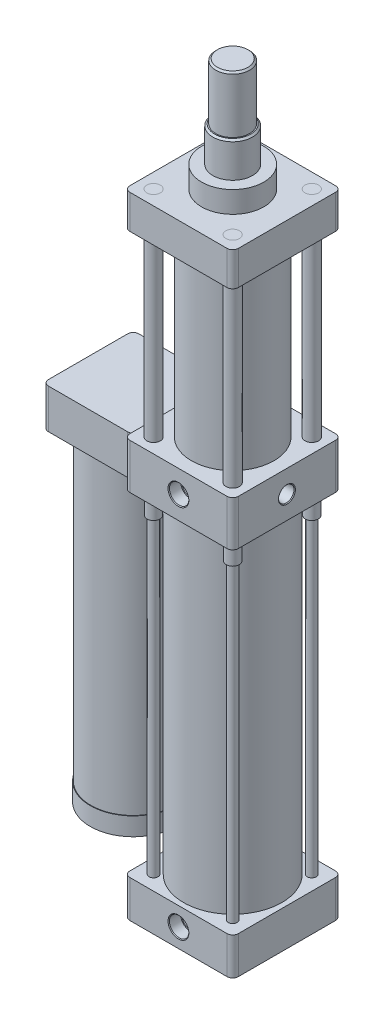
SolidWorks part; units mm, degrees
ref_plane "前视基准面" through (0, 0, 0) normal (0, 0, 1) x (1, 0, 0)
ref_plane "上视基准面" through (0, 0, 0) normal (0, 1, 0) x (1, 0, 0)
ref_plane "右视基准面" through (0, 0, 0) normal (1, 0, 0) x (0, 0, -1)
sketch "草图1" plane through (0, 0, 0) normal (0, 1, 0) x (1, 0, 0)
  line L0 (0, 0) -> (35, 0) construction
  line L1 (43, 48) -> (-43, 48)
  line L2 (48, 43) -> (48, -43)
  line L3 (43, -48) -> (-43, -48)
  line L4 (-48, 43) -> (-48, -43)
  line L5 (48, 48) -> (-48, -48) construction
  line L6 (48, -48) -> (-48, 48) construction
  line L7 (35, 0) -> (35, -35) construction
  arc A0 (-48, -43) -> (-43, -48) centre (-43, -43) ccw
  arc A1 (48, -43) -> (43, -48) centre (43, -43) cw
  arc A2 (43, 48) -> (48, 43) centre (43, 43) cw
  arc A3 (-48, 43) -> (-43, 48) centre (-43, 43) cw
  circle A4 centre (35, -35) radius 6
  circle A5 centre (-35, -35) radius 6
  circle A6 centre (-35, 35) radius 6
  circle A7 centre (35, 35) radius 6
  point P0 (0, 0)
  point P31 (0, 0)
  dimension "D3" = 5
  dimension "D4" = 4
  dimension "D1" = 96
  dimension "D2" = 96
extrude "凸台-拉伸1" add sketch "草图1" along normal blind 30
sketch "草图2" plane through (0, 30, 0) normal (0, 1, 0) x (1, 0, 0)
  circle A0 centre (0, 0) radius 27.5
extrude "凸台-拉伸2" add sketch "草图2" along normal blind 19
sketch "草图3" plane through (0, 49, 0) normal (0, 1, 0) x (1, 0, 0)
  circle A0 centre (0, 0) radius 17.5
extrude "凸台-拉伸3" add sketch "草图3" along normal blind 31
sketch "草图4" plane through (0, 80, 0) normal (0, 1, 0) x (1, 0, 0)
  circle A0 centre (0, 0) radius 15
extrude "凸台-拉伸4" add sketch "草图4" along normal blind 50
chamfer "倒角1" distance 1.5 angle 45 2 edges at (0, 130, 15) (0, 80, 17.5)
sketch "草图5" plane through (0, 0, 0) normal (0, -1, 0) x (1, 0, 0)
  circle A0 centre (0, 0) radius 36.5
extrude "凸台-拉伸5" add sketch "草图5" along normal blind 160
sketch "草图6" plane through (0, -160, 0) normal (0, -1, 0) x (1, 0, 0)
  line L0 (-48, -43) -> (-48, 43) construction
  line L1 (-43, 48) -> (43, 48) construction
  line L2 (48, 43) -> (48, -43) construction
  line L3 (43, -48) -> (-43, -48) construction
  line L4 (-48, -43) -> (-48, 43)
  line L5 (-43, 48) -> (43, 48)
  line L6 (48, 43) -> (48, -43)
  line L7 (43, -48) -> (-43, -48)
  circle A0 centre (-35, -35) radius 6 construction
  arc A1 (-48, -43) -> (-43, -48) centre (-43, -43) ccw construction
  circle A2 centre (-35, 35) radius 6 construction
  arc A3 (-43, 48) -> (-48, 43) centre (-43, 43) ccw construction
  circle A4 centre (35, 35) radius 6 construction
  arc A5 (48, 43) -> (43, 48) centre (43, 43) ccw construction
  circle A6 centre (35, -35) radius 6 construction
  arc A7 (43, -48) -> (48, -43) centre (43, -43) ccw construction
  circle A8 centre (-35, -35) radius 6
  arc A9 (-48, -43) -> (-43, -48) centre (-43, -43) ccw
  circle A10 centre (-35, 35) radius 6
  arc A11 (-43, 48) -> (-48, 43) centre (-43, 43) ccw
  circle A12 centre (35, 35) radius 6
  arc A13 (48, 43) -> (43, 48) centre (43, 43) ccw
  circle A14 centre (35, -35) radius 6
  arc A15 (43, -48) -> (48, -43) centre (43, -43) ccw
extrude "凸台-拉伸6" add sketch "草图6" along normal blind 40
sketch "草图7" plane through (0, -200, 0) normal (0, -1, 0) x (1, 0, 0)
  circle A0 centre (35, -35) radius 5.75
  circle A1 centre (-35, -35) radius 5.75
  circle A2 centre (-35, 35) radius 5.75
  circle A3 centre (35, 35) radius 5.75
extrude "凸台-拉伸7" add sketch "草图7" along normal blind 20 separate body
sketch "草图8" plane through (0, -200, 0) normal (0, -1, 0) x (1, 0, 0)
  circle A0 centre (0, 0) radius 43.5
extrude "凸台-拉伸8" add sketch "草图8" along normal blind 295
sketch "草图9" plane through (0, -495, 0) normal (0, -1, 0) x (1, 0, 0)
  line L4 (-43, -48) -> (43, -48)
  line L5 (48, -43) -> (48, 43)
  line L6 (43, 48) -> (-43, 48)
  line L7 (-48, 43) -> (-48, -43)
  line L8 (-43, -48) -> (43, -48)
  line L9 (48, -43) -> (48, 43)
  line L10 (43, 48) -> (-43, 48)
  line L11 (-48, 43) -> (-48, -43)
  arc A4 (-48, -43) -> (-43, -48) centre (-43, -43) ccw
  arc A5 (43, -48) -> (48, -43) centre (43, -43) ccw
  arc A6 (48, 43) -> (43, 48) centre (43, 43) ccw
  arc A7 (-43, 48) -> (-48, 43) centre (-43, 43) ccw
  arc A8 (-48, -43) -> (-43, -48) centre (-43, -43) ccw
  arc A9 (43, -48) -> (48, -43) centre (43, -43) ccw
  arc A10 (48, 43) -> (43, 48) centre (43, 43) ccw
  arc A11 (-43, 48) -> (-48, 43) centre (-43, 43) ccw
  dimension "D1" = 0
extrude "凸台-拉伸9" add sketch "草图9" along normal blind 33
sketch "草图10" plane through (0, -220, 0) normal (0, -1, 0) x (1, 0, 0)
  circle A0 centre (35, -35) radius 4
  circle A1 centre (-35, -35) radius 4
  circle A2 centre (35, 35) radius 4
  circle A3 centre (-35, 35) radius 4
extrude "凸台-拉伸10" add sketch "草图10" along normal up to surface (275 mm away)
sketch "草图11" plane through (0, 30, 0) normal (0, 1, 0) x (1, 0, 0)
  circle A0 centre (35, -35) radius 6 construction
  circle A1 centre (35, 35) radius 6 construction
  circle A2 centre (-35, 35) radius 6 construction
  circle A3 centre (-35, -35) radius 6 construction
  circle A4 centre (35, -35) radius 6
  circle A5 centre (35, 35) radius 6
  circle A6 centre (-35, 35) radius 6
  circle A7 centre (-35, -35) radius 6
extrude "凸台-拉伸11" add sketch "草图11" against normal up to surface (190 mm away) separate body
ref_plane "基准面1" through (0, -162.5, 0) normal (0, 1, 0) x (1, 0, 0)
sketch "草图12" plane through (0, -162.5, 0) normal (0, 1, 0) x (1, 0, 0)
  line L2 (-48, 0) -> (-88, 0) construction
  line L3 (-123, 40) -> (-53, 40)
  line L4 (-128, 35) -> (-128, -35)
  line L5 (-123, -40) -> (-53, -40)
  line L6 (-48, 35) -> (-48, -35)
  line L7 (-128, 40) -> (-48, -40) construction
  line L8 (-128, -40) -> (-48, 40) construction
  arc A0 (-48, 35) -> (-53, 40) centre (-53, 35) ccw
  arc A1 (-128, 35) -> (-123, 40) centre (-123, 35) cw
  arc A2 (-53, -40) -> (-48, -35) centre (-53, -35) ccw
  arc A3 (-123, -40) -> (-128, -35) centre (-123, -35) cw
  dimension "D3" = 5
  dimension "D1" = 80
  dimension "D2" = 80
extrude "凸台-拉伸12" add sketch "草图12" against normal blind 35 separate body
sketch "草图13" plane through (0, -197.5, 0) normal (0, -1, 0) x (1, 0, 0)
  line L0 (-88, -40) -> (-88, 40) construction
  line L1 (-53, -40) -> (-123, -40) construction
  circle A0 centre (-88, 0) radius 37.5
extrude "凸台-拉伸13" add sketch "草图13" along normal blind 270 separate body
sketch "草图14" plane through (0, -467.5, 0) normal (0, -1, 0) x (1, 0, 0)
  circle A0 centre (-88, 0) radius 38
extrude "凸台-拉伸14" add sketch "草图14" along normal blind 16 separate body
sketch "草图15" plane through (0, -483.5, 0) normal (0, -1, 0) x (1, 0, 0)
  line L1 (-101.8564, 0) -> (-94.9282, -12)
  line L2 (-94.9282, -12) -> (-81.0718, -12)
  line L3 (-81.0718, -12) -> (-74.1436, 0)
  line L4 (-74.1436, 0) -> (-81.0718, 12)
  line L5 (-81.0718, 12) -> (-94.9282, 12)
  line L6 (-94.9282, 12) -> (-101.8564, 0)
  circle A0 centre (-88, 0) radius 12 construction
extrude "凸台-拉伸15" add sketch "草图15" along normal blind 12 separate body
hole_wizard "1/4 NPT 螺纹孔1" positions "草图16" profile "草图17" size "1/4" standard "ANSI Inch"
sketch "草图16" plane through (0, 0, -48) normal (0, 0, -1) x (-1, 0, 0)
  line L0 (43, -200) -> (-43, -200) construction
  point P0 (2.9036, -180)
  dimension "D1" = 20
sketch "草图17" plane through (-2.9036, -180, -48) normal (1, 0, 0) x (0, 1, 0)
  line L0 (0, 0) -> (0, 20.4123)
  line L1 (5.5626, 17.07) -> (0, 20.4123)
  line L2 (-5.5626, 17.07) -> (0, 20.4123) construction
  line L3 (5.5626, 17.07) -> (5.5626, 10.02)
  line L4 (5.5626, 10.02) -> (6.577, 10.02)
  line L5 (6.577, 10.02) -> (6.858, 0.635)
  line L6 (6.858, 0.635) -> (7.493, 0)
  line L7 (7.493, 0) -> (0, 0)
  line L8 (0, -6.35) -> (0, 107.95) construction
  line L9 (-6.858, 0.635) -> (-7.493, 0) construction
  line L11 (-5.5626, 10.02) -> (-6.577, 10.02) construction
  line L12 (-6.577, 10.02) -> (-6.858, 0.635) construction
  dimension "螺纹孔钻头直径" = 11.1252
  dimension "螺纹孔钻头深度" = 17.07
  dimension "螺纹直径" = 13.716
  dimension "螺纹角度" = 3.43
  dimension "螺纹深度" = 10.02
  dimension "锥形沉头孔直径" = 14.986
  dimension "锥形沉头孔角度" = 90
  dimension "导头角度" = 118
hole_wizard "1/4 NPT 螺纹孔2" positions "草图18" profile "草图19" size "1/4" standard "ANSI Inch"
sketch "草图18" plane through (48, 0, 0) normal (1, 0, 0) x (0, 0, -1)
  line L0 (43, -200) -> (-43, -200) construction
  point P0 (0, -180)
  dimension "D1" = 20
sketch "草图19" plane through (48, -180, 0) normal (0, 1, 0) x (0, 0, -1)
  line L0 (0, 0) -> (0, 20.4123)
  line L1 (5.5626, 17.07) -> (0, 20.4123)
  line L2 (-5.5626, 17.07) -> (0, 20.4123) construction
  line L3 (5.5626, 17.07) -> (5.5626, 10.02)
  line L4 (5.5626, 10.02) -> (6.577, 10.02)
  line L5 (6.577, 10.02) -> (6.858, 0.635)
  line L6 (6.858, 0.635) -> (7.493, 0)
  line L7 (7.493, 0) -> (0, 0)
  line L8 (0, -6.35) -> (0, 107.95) construction
  line L9 (-6.858, 0.635) -> (-7.493, 0) construction
  line L11 (-5.5626, 10.02) -> (-6.577, 10.02) construction
  line L12 (-6.577, 10.02) -> (-6.858, 0.635) construction
  dimension "螺纹孔钻头直径" = 11.1252
  dimension "螺纹孔钻头深度" = 17.07
  dimension "螺纹直径" = 13.716
  dimension "螺纹角度" = 3.43
  dimension "螺纹深度" = 10.02
  dimension "锥形沉头孔直径" = 14.986
  dimension "锥形沉头孔角度" = 90
  dimension "导头角度" = 118
hole_wizard "3/8 NPT 螺纹孔1" positions "草图20" profile "草图21" size "3/8" standard "ANSI Inch"
sketch "草图20" plane through (-48, 0, 0) normal (-1, 0, 0) x (0, 0, 1)
  line L0 (-43, 30) -> (43, 30) construction
  point P0 (0, 15)
  dimension "D1" = 15
sketch "草图21" plane through (-48, 15, 0) normal (0, 1, 0) x (0, 0, 1)
  line L0 (0, 0) -> (0, 21.6686)
  line L1 (7.1374, 17.38) -> (0, 21.6686)
  line L2 (-7.1374, 17.38) -> (0, 21.6686) construction
  line L3 (7.1374, 17.38) -> (7.1374, 10.33)
  line L4 (7.1374, 10.33) -> (8.2822, 10.33)
  line L5 (8.2822, 10.33) -> (8.5725, 0.635)
  line L6 (8.5725, 0.635) -> (9.2075, 0)
  line L7 (9.2075, 0) -> (0, 0)
  line L8 (0, -6.35) -> (0, 107.95) construction
  line L9 (-8.5725, 0.635) -> (-9.2075, 0) construction
  line L11 (-7.1374, 10.33) -> (-8.2822, 10.33) construction
  line L12 (-8.2822, 10.33) -> (-8.5725, 0.635) construction
  dimension "螺纹孔钻头直径" = 14.2748
  dimension "螺纹孔钻头深度" = 17.38
  dimension "螺纹直径" = 17.145
  dimension "螺纹角度" = 3.43
  dimension "螺纹深度" = 10.33
  dimension "锥形沉头孔直径" = 18.415
  dimension "锥形沉头孔角度" = 90
  dimension "导头角度" = 118
hole_wizard "3/8 NPT 螺纹孔2" positions "草图22" profile "草图23" size "3/8" standard "ANSI Inch"
sketch "草图22" plane through (0, 0, 48) normal (0, 0, 1) x (1, 0, 0)
  line L0 (43, -160) -> (-43, -160) construction
  line L1 (43, -528) -> (-43, -528) construction
  point P0 (0, -511.5)
  point P2 (0, -180)
  dimension "D1" = 20
  dimension "D2" = 16.5
sketch "草图23" plane through (0, -511.5, 48) normal (1, 0, 0) x (0, -1, 0)
  line L0 (0, 0) -> (0, 21.6686)
  line L1 (7.1374, 17.38) -> (0, 21.6686)
  line L2 (-7.1374, 17.38) -> (0, 21.6686) construction
  line L3 (7.1374, 17.38) -> (7.1374, 10.33)
  line L4 (7.1374, 10.33) -> (8.2822, 10.33)
  line L5 (8.2822, 10.33) -> (8.5725, 0.635)
  line L6 (8.5725, 0.635) -> (9.2075, 0)
  line L7 (9.2075, 0) -> (0, 0)
  line L8 (0, -6.35) -> (0, 107.95) construction
  line L9 (-8.5725, 0.635) -> (-9.2075, 0) construction
  line L11 (-7.1374, 10.33) -> (-8.2822, 10.33) construction
  line L12 (-8.2822, 10.33) -> (-8.5725, 0.635) construction
  dimension "螺纹孔钻头直径" = 14.2748
  dimension "螺纹孔钻头深度" = 17.38
  dimension "螺纹直径" = 17.145
  dimension "螺纹角度" = 3.43
  dimension "螺纹深度" = 10.33
  dimension "锥形沉头孔直径" = 18.415
  dimension "锥形沉头孔角度" = 90
  dimension "导头角度" = 118
hole_wizard "3/8 NPT 螺纹孔3" positions "草图24" profile "草图25" size "3/8" standard "ANSI Inch"
sketch "草图24" plane through (0, -495.5, 0) normal (0, -1, 0) x (-1, 0, 0)
  line L1 (94.9282, -12) -> (101.8564, 0) construction
  line L2 (101.8564, 0) -> (94.9282, 12) construction
  point P0 (88, 0)
  dimension "D1" = 12
  dimension "D2" = 12
sketch "草图25" plane through (-88, -495.5, 0) normal (1, 0, 0) x (0, 0, -1)
  line L0 (0, 0) -> (0, 21.6686)
  line L1 (7.1374, 17.38) -> (0, 21.6686)
  line L2 (-7.1374, 17.38) -> (0, 21.6686) construction
  line L3 (7.1374, 17.38) -> (7.1374, 10.33)
  line L4 (7.1374, 10.33) -> (8.2822, 10.33)
  line L5 (8.2822, 10.33) -> (8.5725, 0.635)
  line L6 (8.5725, 0.635) -> (9.2075, 0)
  line L7 (9.2075, 0) -> (0, 0)
  line L8 (0, -6.35) -> (0, 107.95) construction
  line L9 (-8.5725, 0.635) -> (-9.2075, 0) construction
  line L11 (-7.1374, 10.33) -> (-8.2822, 10.33) construction
  line L12 (-8.2822, 10.33) -> (-8.5725, 0.635) construction
  dimension "螺纹孔钻头直径" = 14.2748
  dimension "螺纹孔钻头深度" = 17.38
  dimension "螺纹直径" = 17.145
  dimension "螺纹角度" = 3.43
  dimension "螺纹深度" = 10.33
  dimension "锥形沉头孔直径" = 18.415
  dimension "锥形沉头孔角度" = 90
  dimension "导头角度" = 118
